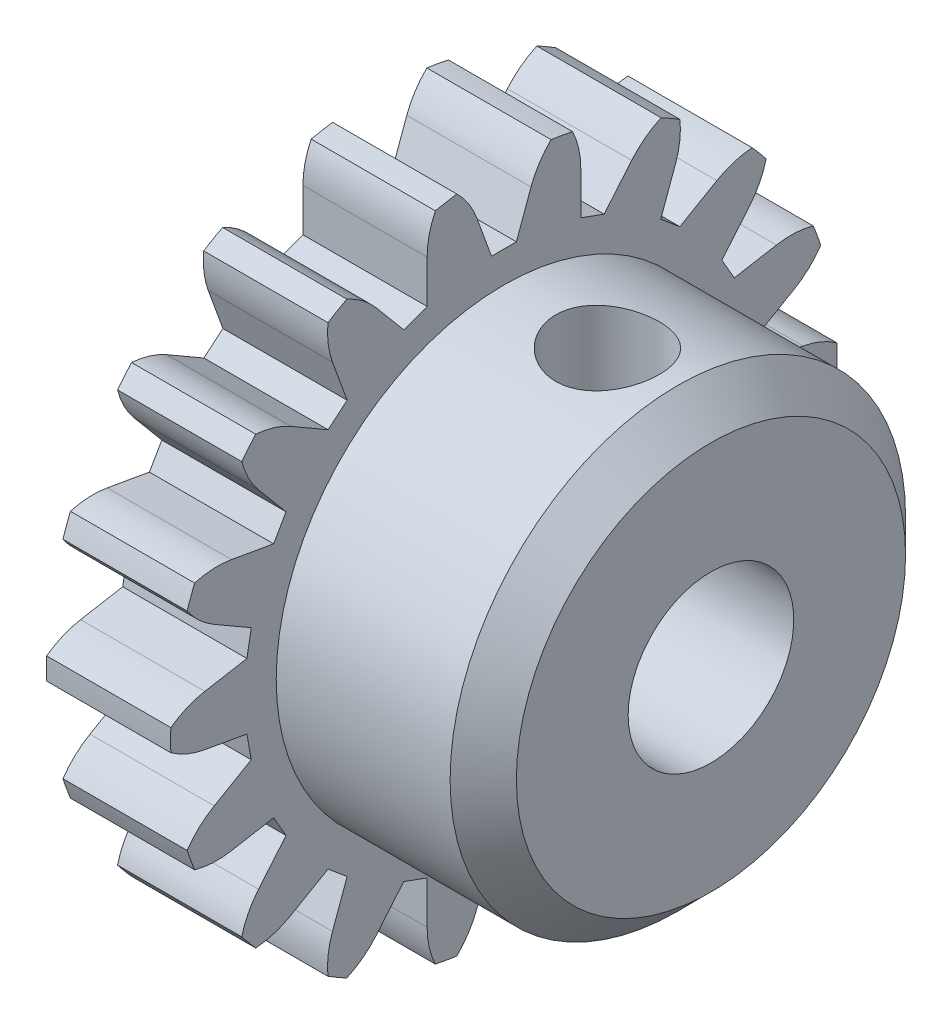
SolidWorks part; units mm, degrees
ref_plane "Plan de face" through (0, 0, 0) normal (0, 0, 1) x (1, 0, 0)
ref_plane "Plan de dessus" through (0, 0, 0) normal (0, 1, 0) x (1, 0, 0)
ref_plane "Plan de droite" through (0, 0, 0) normal (1, 0, 0) x (0, 0, -1)
sketch "Esquisse1" plane through (0, 0, 0) normal (0, 0, 1) x (1, 0, 0)
  line L0 (-19.4483, 0) -> (45.9971, 0) construction
  line L1 (0, 2) -> (8, 2)
  line L3 (0, 2) -> (0, 8.05)
  line L4 (0, 8.05) -> (3, 8.05)
  line L5 (3, 5.5) -> (3, 8.05)
  line L6 (3, 5.5) -> (8, 5.5)
  line L9 (8, 5.5) -> (8, 2)
  dimension "D1" = 2
  dimension "D2" = 3
  dimension "D3" = 5
  dimension "D4" = 8.05
  dimension "D5" = 3.5
revolve "Révolution1" add sketch "Esquisse1" angle 360 about L0
sketch "Esquisse2" plane through (0, 0, 0) normal (-1, 0, 0) x (0, 0, 1)
  line L0 (0, 17.9781) -> (0, -0.7899) construction
  line L1 (-2.5335, 8.5364) -> (2.5326, 8.5365)
  line L2 (0.6532, 7.2205) -> (0.3, 6.25)
  line L3 (0.3, 6.25) -> (-0.3009, 6.25)
  line L4 (-0.3009, 6.25) -> (-0.6541, 7.2204)
  arc A0 (2.5326, 8.5365) -> (0.6532, 7.2205) centre (2.5326, 6.5365) ccw
  circle A1 centre (0, 0) radius 7.25 construction
  arc A2 (-0.6541, 7.2204) -> (-2.5335, 8.5364) centre (-2.5334, 6.5364) ccw
  dimension "D6" = 14.5
  dimension "D3" = 4
  dimension "D1" = 70
  dimension "D2" = 70
  dimension "D5" = 0.3
extrude "Enlèv. mat.-Extru.1" cut sketch "Esquisse2" against normal through all
pattern_circular "Répétition circulaire1" count 18 over 360 about axis through (0, 0, 0) along (1, 0, 0) of "Enlèv. mat.-Extru.1"
chamfer "Chanfrein1" distance 0.8 angle 45 1 edges at (8, 0, 5.5)
sketch "Esquisse3" plane through (0, 0, 0) normal (0, 1, 0) x (1, 0, 0)
  line L0 (7.2, 0) -> (3, 0) construction
  circle A0 centre (5.5, 0) radius 1.25
  dimension "D1" = 2.5
  dimension "D2" = 5.5
extrude "Enlèv. mat.-Extru.2" cut sketch "Esquisse3" along normal blind 20
